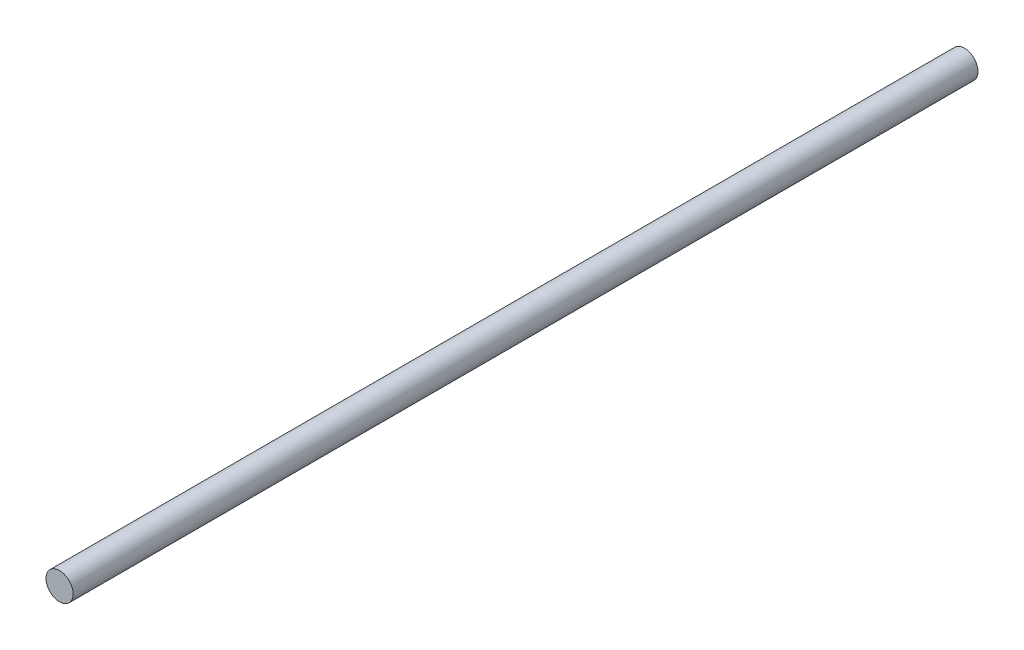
SolidWorks part; units mm, degrees
ref_plane "Front Plane" through (0, 0, 0) normal (0, 0, 1) x (1, 0, 0)
ref_plane "Top Plane" through (0, 0, 0) normal (0, 1, 0) x (1, 0, 0)
ref_plane "Right Plane" through (0, 0, 0) normal (1, 0, 0) x (0, 0, -1)
sketch "Sketch1" plane through (0, 0, 0) normal (0, 0, 1) x (1, 0, 0)
  circle A0 centre (0, 0) radius 30
  dimension "D1" = 60
extrude "Boss-Extrude1" add sketch "Sketch1" against normal blind 2000
